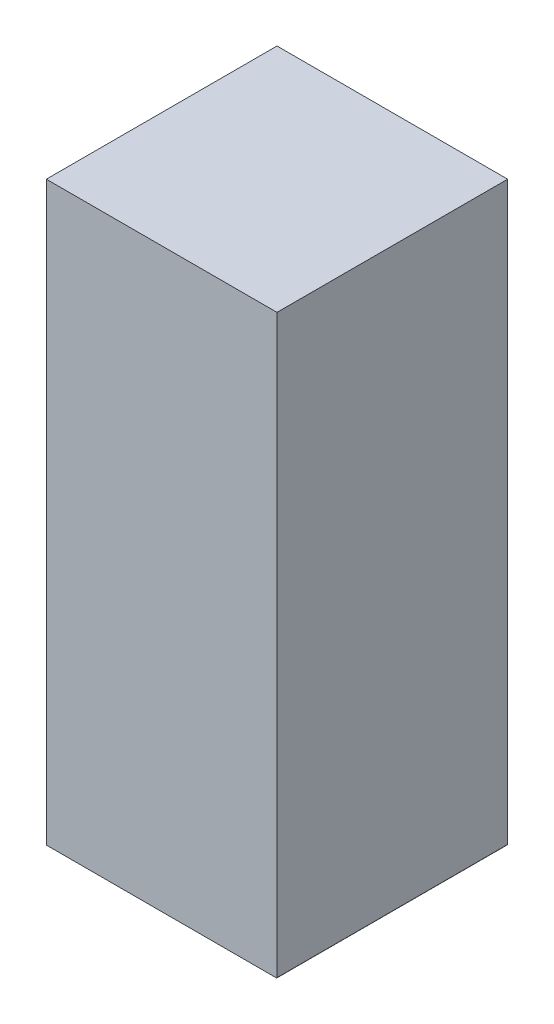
SolidWorks part; units mm, degrees
ref_plane "Front" through (0, 0, 0) normal (0, 0, 1) x (1, 0, 0)
ref_plane "Top" through (0, 0, 0) normal (0, 1, 0) x (1, 0, 0)
ref_plane "Right" through (0, 0, 0) normal (1, 0, 0) x (0, 0, -1)
sketch "Sketch1" plane through (0, 0, 0) normal (0, 1, 0) x (1, 0, 0)
  line L1 (400, -400) -> (-400, -400)
  line L2 (400, -400) -> (400, 400)
  line L3 (400, 400) -> (-400, 400)
  line L4 (-400, -400) -> (-400, 400)
  line L5 (400, -400) -> (-400, 400) construction
  line L6 (400, 400) -> (-400, -400) construction
  point P0 (0, 0)
  dimension "D1" = 800
  dimension "D2" = 800
extrude "Boss-Extrude1" add sketch "Sketch1" along normal blind 2000
fillet "Fillet1" radius 2 1 edges at (400, 0, 0)
